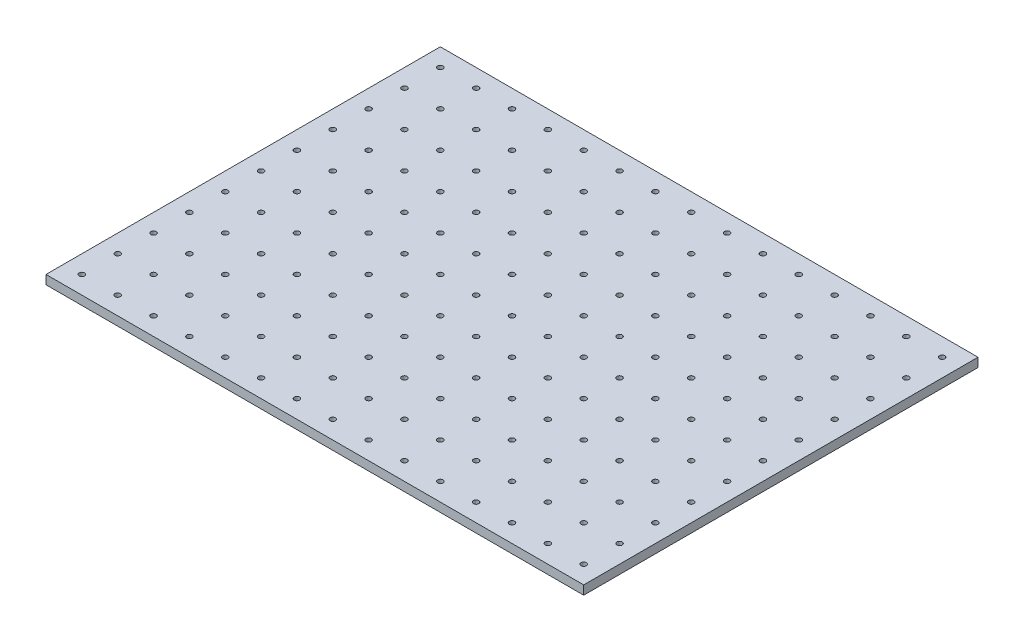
SolidWorks part; units mm, degrees
ref_plane "Front Plane" through (0, 0, 0) normal (0, 0, 1) x (1, 0, 0)
ref_plane "Top Plane" through (0, 0, 0) normal (0, 1, 0) x (1, 0, 0)
ref_plane "Right Plane" through (0, 0, 0) normal (1, 0, 0) x (0, 0, -1)
sketch "Sketch1" plane through (0, 0, 0) normal (0, 1, 0) x (1, 0, 0)
  line L1 (-150, 110) -> (150, 110)
  line L2 (-150, 110) -> (-150, -110)
  line L3 (-150, -110) -> (150, -110)
  line L4 (150, 110) -> (150, -110)
  line L6 (-150, -110) -> (150, 110) construction
  circle A0 centre (-140, 100) radius 1.5
  circle A1 centre (-120, 100) radius 1.5
  circle A2 centre (-100, 100) radius 1.5
  circle A3 centre (-80, 100) radius 1.5
  circle A4 centre (-60, 100) radius 1.5
  circle A5 centre (-40, 100) radius 1.5
  circle A6 centre (-20, 100) radius 1.5
  circle A7 centre (0, 100) radius 1.5
  circle A8 centre (20, 100) radius 1.5
  circle A9 centre (40, 100) radius 1.5
  circle A10 centre (60, 100) radius 1.5
  circle A11 centre (80, 100) radius 1.5
  circle A12 centre (100, 100) radius 1.5
  circle A13 centre (120, 100) radius 1.5
  circle A14 centre (140, 100) radius 1.5
  circle A15 centre (-120, 80) radius 1.5
  circle A16 centre (-100, 80) radius 1.5
  circle A17 centre (-80, 80) radius 1.5
  circle A18 centre (-60, 80) radius 1.5
  circle A19 centre (-40, 80) radius 1.5
  circle A20 centre (-20, 80) radius 1.5
  circle A21 centre (0, 80) radius 1.5
  circle A22 centre (20, 80) radius 1.5
  circle A23 centre (40, 80) radius 1.5
  circle A24 centre (60, 80) radius 1.5
  circle A25 centre (80, 80) radius 1.5
  circle A26 centre (100, 80) radius 1.5
  circle A27 centre (120, 80) radius 1.5
  circle A28 centre (140, 80) radius 1.5
  circle A29 centre (-120, 60) radius 1.5
  circle A30 centre (-100, 60) radius 1.5
  circle A31 centre (-80, 60) radius 1.5
  circle A32 centre (-60, 60) radius 1.5
  circle A33 centre (-40, 60) radius 1.5
  circle A34 centre (-20, 60) radius 1.5
  circle A35 centre (0, 60) radius 1.5
  circle A36 centre (20, 60) radius 1.5
  circle A37 centre (40, 60) radius 1.5
  circle A38 centre (60, 60) radius 1.5
  circle A39 centre (80, 60) radius 1.5
  circle A40 centre (100, 60) radius 1.5
  circle A41 centre (120, 60) radius 1.5
  circle A42 centre (140, 60) radius 1.5
  circle A43 centre (-120, 40) radius 1.5
  circle A44 centre (-100, 40) radius 1.5
  circle A45 centre (-80, 40) radius 1.5
  circle A46 centre (-60, 40) radius 1.5
  circle A47 centre (-40, 40) radius 1.5
  circle A48 centre (-20, 40) radius 1.5
  circle A49 centre (0, 40) radius 1.5
  circle A50 centre (20, 40) radius 1.5
  circle A51 centre (40, 40) radius 1.5
  circle A52 centre (60, 40) radius 1.5
  circle A53 centre (80, 40) radius 1.5
  circle A54 centre (100, 40) radius 1.5
  circle A55 centre (120, 40) radius 1.5
  circle A56 centre (140, 40) radius 1.5
  circle A57 centre (-120, 20) radius 1.5
  circle A58 centre (-100, 20) radius 1.5
  circle A59 centre (-80, 20) radius 1.5
  circle A60 centre (-60, 20) radius 1.5
  circle A61 centre (-40, 20) radius 1.5
  circle A62 centre (-20, 20) radius 1.5
  circle A63 centre (0, 20) radius 1.5
  circle A64 centre (20, 20) radius 1.5
  circle A65 centre (40, 20) radius 1.5
  circle A66 centre (60, 20) radius 1.5
  circle A67 centre (80, 20) radius 1.5
  circle A68 centre (100, 20) radius 1.5
  circle A69 centre (120, 20) radius 1.5
  circle A70 centre (140, 20) radius 1.5
  circle A71 centre (-120, 0) radius 1.5
  circle A72 centre (-100, 0) radius 1.5
  circle A73 centre (-80, 0) radius 1.5
  circle A74 centre (-60, 0) radius 1.5
  circle A75 centre (-40, 0) radius 1.5
  circle A76 centre (-20, 0) radius 1.5
  circle A77 centre (0, 0) radius 1.5
  circle A78 centre (20, 0) radius 1.5
  circle A79 centre (40, 0) radius 1.5
  circle A80 centre (60, 0) radius 1.5
  circle A81 centre (80, 0) radius 1.5
  circle A82 centre (100, 0) radius 1.5
  circle A83 centre (120, 0) radius 1.5
  circle A84 centre (140, 0) radius 1.5
  circle A85 centre (-120, -20) radius 1.5
  circle A86 centre (-100, -20) radius 1.5
  circle A87 centre (-80, -20) radius 1.5
  circle A88 centre (-60, -20) radius 1.5
  circle A89 centre (-40, -20) radius 1.5
  circle A90 centre (-20, -20) radius 1.5
  circle A91 centre (0, -20) radius 1.5
  circle A92 centre (20, -20) radius 1.5
  circle A93 centre (40, -20) radius 1.5
  circle A94 centre (60, -20) radius 1.5
  circle A95 centre (80, -20) radius 1.5
  circle A96 centre (100, -20) radius 1.5
  circle A97 centre (120, -20) radius 1.5
  circle A98 centre (140, -20) radius 1.5
  circle A99 centre (-120, -40) radius 1.5
  circle A100 centre (-100, -40) radius 1.5
  circle A101 centre (-80, -40) radius 1.5
  circle A102 centre (-60, -40) radius 1.5
  circle A103 centre (-40, -40) radius 1.5
  circle A104 centre (-20, -40) radius 1.5
  circle A105 centre (0, -40) radius 1.5
  circle A106 centre (20, -40) radius 1.5
  circle A107 centre (40, -40) radius 1.5
  circle A108 centre (60, -40) radius 1.5
  circle A109 centre (80, -40) radius 1.5
  circle A110 centre (100, -40) radius 1.5
  circle A111 centre (120, -40) radius 1.5
  circle A112 centre (140, -40) radius 1.5
  circle A113 centre (-120, -60) radius 1.5
  circle A114 centre (-100, -60) radius 1.5
  circle A115 centre (-80, -60) radius 1.5
  circle A116 centre (-60, -60) radius 1.5
  circle A117 centre (-40, -60) radius 1.5
  circle A118 centre (-20, -60) radius 1.5
  circle A119 centre (0, -60) radius 1.5
  circle A120 centre (20, -60) radius 1.5
  circle A121 centre (40, -60) radius 1.5
  circle A122 centre (60, -60) radius 1.5
  circle A123 centre (80, -60) radius 1.5
  circle A124 centre (100, -60) radius 1.5
  circle A125 centre (120, -60) radius 1.5
  circle A126 centre (140, -60) radius 1.5
  circle A127 centre (-120, -80) radius 1.5
  circle A128 centre (-100, -80) radius 1.5
  circle A129 centre (-80, -80) radius 1.5
  circle A130 centre (-60, -80) radius 1.5
  circle A131 centre (-40, -80) radius 1.5
  circle A132 centre (-20, -80) radius 1.5
  circle A133 centre (0, -80) radius 1.5
  circle A134 centre (20, -80) radius 1.5
  circle A135 centre (40, -80) radius 1.5
  circle A136 centre (60, -80) radius 1.5
  circle A137 centre (80, -80) radius 1.5
  circle A138 centre (100, -80) radius 1.5
  circle A139 centre (120, -80) radius 1.5
  circle A140 centre (140, -80) radius 1.5
  circle A141 centre (-120, -100) radius 1.5
  circle A142 centre (-100, -100) radius 1.5
  circle A143 centre (-80, -100) radius 1.5
  circle A144 centre (-60, -100) radius 1.5
  circle A145 centre (-40, -100) radius 1.5
  circle A146 centre (-20, -100) radius 1.5
  circle A147 centre (0, -100) radius 1.5
  circle A148 centre (20, -100) radius 1.5
  circle A149 centre (40, -100) radius 1.5
  circle A150 centre (60, -100) radius 1.5
  circle A151 centre (80, -100) radius 1.5
  circle A152 centre (100, -100) radius 1.5
  circle A153 centre (120, -100) radius 1.5
  circle A154 centre (140, -100) radius 1.5
  circle A155 centre (-140, 80) radius 1.5
  circle A156 centre (-140, 60) radius 1.5
  circle A157 centre (-140, 40) radius 1.5
  circle A158 centre (-140, 20) radius 1.5
  circle A159 centre (-140, 0) radius 1.5
  circle A160 centre (-140, -20) radius 1.5
  circle A161 centre (-140, -40) radius 1.5
  circle A162 centre (-140, -60) radius 1.5
  circle A163 centre (-140, -80) radius 1.5
  circle A164 centre (-140, -100) radius 1.5
  point P0 (0, 0)
  dimension "D3" = 3
  dimension "D1" = 300
  dimension "D2" = 220
  dimension "D4" = 10
  dimension "D5" = 10
  dimension "D6" = 15
  dimension "D7" = 11
extrude "Boss-Extrude1" add sketch "Sketch1" along normal blind 5
